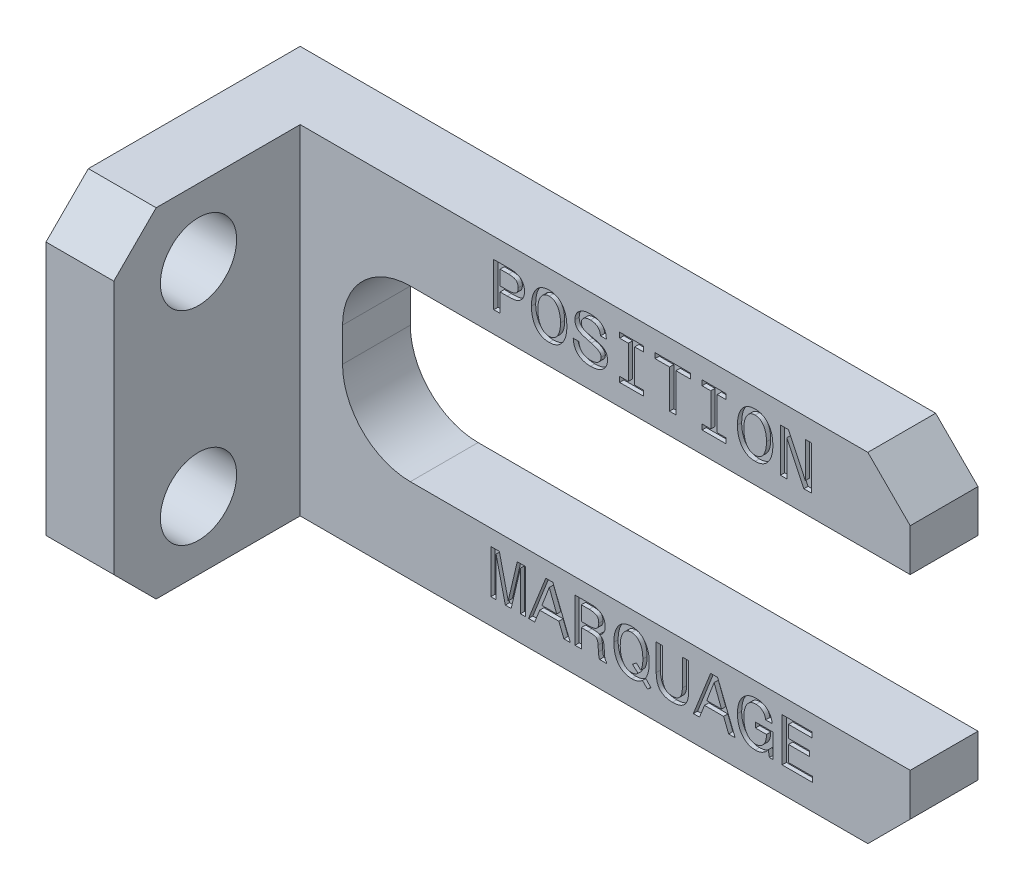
SolidWorks part; units mm, degrees
ref_plane "Plan de face" through (0, 0, 0) normal (0, 0, 1) x (1, 0, 0)
ref_plane "Plan de dessus" through (0, 0, 0) normal (0, 1, 0) x (1, 0, 0)
ref_plane "Plan de droite" through (0, 0, 0) normal (1, 0, 0) x (0, 0, -1)
sketch "Esquisse1" plane through (0, 0, 0) normal (0, 0, 1) x (1, 0, 0)
  line L0 (80, -10) -> (80, -20)
  line L1 (0, 20) -> (80, 20)
  line L2 (0, 20) -> (0, -20)
  line L3 (0, -20) -> (80, -20)
  line L4 (80, 20) -> (80, 10)
  line L5 (21, 10) -> (80, 10)
  line L6 (13, 2) -> (13, -2)
  line L7 (21, -10) -> (80, -10)
  arc A0 (21, -10) -> (13, -2) centre (21, -2) cw
  arc A1 (13, 2) -> (21, 10) centre (21, 2) cw
  point P12 (0, 0)
  dimension "D2" = 8
  dimension "D1" = 67
  dimension "D3" = 80
  dimension "D4" = 40
  dimension "D5" = 10
  dimension "D6" = 20
extrude "Boss.-Extru.1" add sketch "Esquisse1" along normal blind 8
sketch "Esquisse2" plane through (0, 0, 8) normal (0, 0, 1) x (1, 0, 0)
  line L0 (0, -20) -> (80, -20) construction
  line L1 (0, 20) -> (8, 20)
  line L2 (0, 20) -> (0, -20)
  line L3 (0, -20) -> (8, -20)
  line L4 (8, 20) -> (8, -20)
  dimension "D1" = 8
extrude "Boss.-Extru.2" add sketch "Esquisse2" along normal blind 22
chamfer "Chanfrein1" distance 5 angle 45 4 edges at (80, 20, 4) (80, -20, 4) (4, -20, 30) (4, 20, 30)
sketch "Esquisse3" plane through (0, 0, 8) normal (0, 0, 1) x (1, 0, 0)
  line L0 (30.0905, 12.5) -> (83.3464, 12.5) construction
  line L3 (22.0032, 18) -> (77.9495, 18) construction
  text T0 "POSITION      MARQUAGE" font "Monospac821 BT" height in points 20
  dimension "D1" = 12.5
  dimension "D2" = 18
extrude "Enlèv. mat.-Extru.1" cut sketch "Esquisse3" against normal blind 0.5
sketch "Esquisse4" plane through (8, 0, 0) normal (1, 0, 0) x (0, 0, -1)
  line L0 (-25, 20) -> (-8, 20) construction
  line L1 (0, 20) -> (0, 15) construction
  circle A0 centre (-20, 12) radius 4.5
  circle A1 centre (-20, -12) radius 4.5
  dimension "D1" = 8
  dimension "D2" = 9
  dimension "D3" = 9
  dimension "D4" = 20
  dimension "D5" = 24
extrude "Enlèv. mat.-Extru.2" cut sketch "Esquisse4" against normal through all
